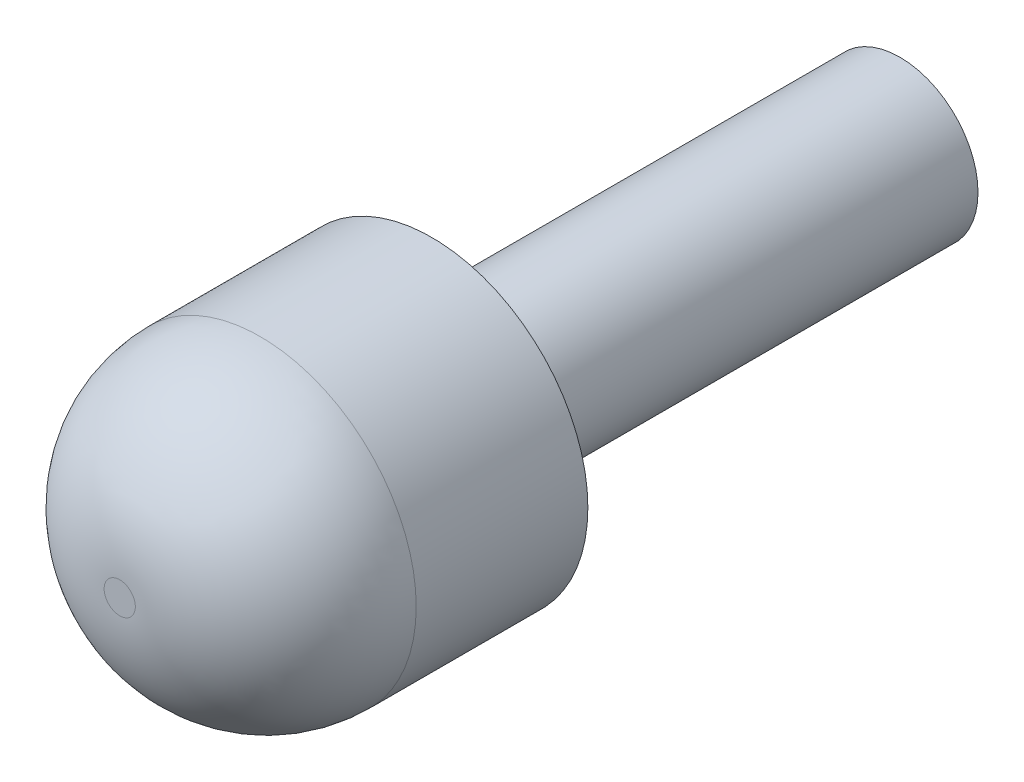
SolidWorks part; units mm, degrees
ref_plane "Front" through (0, 0, 0) normal (0, 0, 1) x (1, 0, 0)
ref_plane "Top" through (0, 0, 0) normal (0, 1, 0) x (1, 0, 0)
ref_plane "Right" through (0, 0, 0) normal (1, 0, 0) x (0, 0, -1)
sketch "Sketch1" plane through (0, 0, 0) normal (0, 0, 1) x (1, 0, 0)
  circle A0 centre (0, 0) radius 2
extrude "Base-Extrude" add sketch "Sketch1" against normal blind 4
fillet "Fillet1" radius 1.8 1 edges at (2, 0, 0)
sketch "Sketch2" plane through (0, 0, -4) normal (0, 0, -1) x (-1, 0, 0)
  circle A0 centre (0, 0) radius 1
extrude "Boss-Extrude1" add sketch "Sketch2" along normal blind 6
sketch "Sketch3" plane through (0, 0, -10) normal (0, 0, -1) x (-1, 0, 0)
  line L0 (0, 0) -> (0.9166, 0) construction
  line L1 (-0.5, -0.5) -> (0.5, -0.5)
  line L2 (-0.5, -0.5) -> (-0.5, 0.5)
  line L3 (-0.5, 0.5) -> (0.5, 0.5)
  line L4 (0.5, -0.5) -> (0.5, 0.5)
  line L5 (0, 0) -> (0, 0.8506) construction
  dimension "D1" = 1
  dimension "D2" = 1
  dimension "D3" = 0.5
  dimension "D4" = 0.5
extrude "Cut-Extrude1" cut sketch "Sketch3" against normal blind 1
